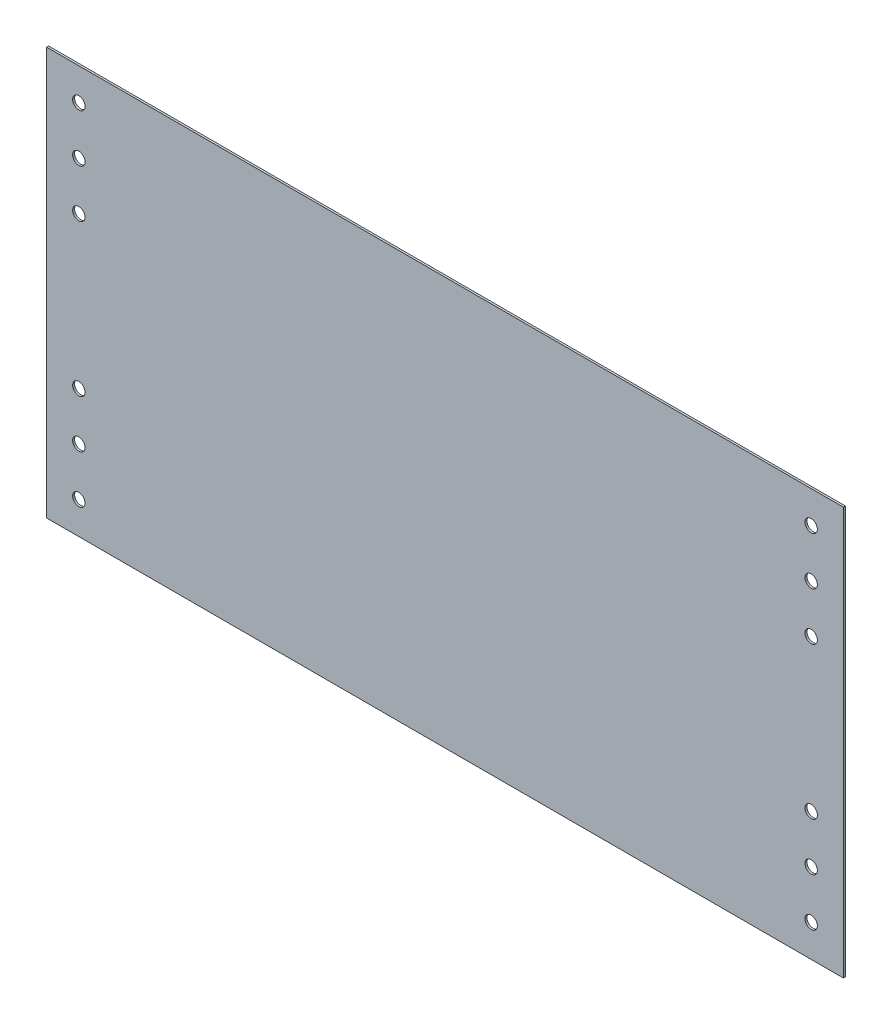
SolidWorks part; units mm, degrees
ref_plane "Front Plane" through (0, 0, 0) normal (0, 0, 1) x (1, 0, 0)
ref_plane "Top Plane" through (0, 0, 0) normal (0, 1, 0) x (1, 0, 0)
ref_plane "Right Plane" through (0, 0, 0) normal (1, 0, 0) x (0, 0, -1)
sketch "Sketch1" plane through (0, 0, 0) normal (0, 0, 1) x (1, 0, 0)
  line L0 (-289.1991, 355.7444) -> (289.1991, 355.7444) construction
  point P0 (0, 152.4)
  point P3 (0, 355.7444)
  line B0 (-597.6938, 152.4) -> (597.6938, 152.4)
  arc B1 (-289.1991, 117.3914) -> (-289.1991, 126.9164) centre (-289.1991, 122.1539) ccw
  arc B2 (-289.1991, 79.492) -> (-289.1991, 89.017) centre (-289.1991, 84.2545) ccw
  arc B3 (-289.1991, 41.5925) -> (-289.1991, 51.1175) centre (-289.1991, 46.355) ccw
  arc B4 (-289.1991, 389.0819) -> (-289.1991, 398.6069) centre (-289.1991, 393.8444) ccw
  arc B5 (-289.1991, 351.1825) -> (-289.1991, 360.7075) centre (-289.1991, 355.945) ccw
  arc B6 (-289.1991, 313.283) -> (-289.1991, 322.808) centre (-289.1991, 318.0455) ccw
  arc B7 (289.1991, 398.6069) -> (289.1991, 389.0819) centre (289.1991, 393.8444) ccw
  arc B8 (289.1991, 360.7075) -> (289.1991, 351.1825) centre (289.1991, 355.945) ccw
  arc B9 (289.1991, 322.808) -> (289.1991, 313.283) centre (289.1991, 318.0455) ccw
  arc B10 (289.1991, 126.9164) -> (289.1991, 117.3914) centre (289.1991, 122.1539) ccw
  arc B11 (289.1991, 89.017) -> (289.1991, 79.492) centre (289.1991, 84.2545) ccw
  arc B12 (289.1991, 51.1175) -> (289.1991, 41.5925) centre (289.1991, 46.355) ccw
  dimension "D1" = 152.4
  dimension "D2" = 38.1
sketch_block_instance "Block1-1"
sketch_block "Block1"
sketch "Holes to lineup" plane through (0, 0, 0) normal (0, 0, 1) x (1, 0, 0)
  line L0 (-289.1991, 241.8455) -> (289.1991, 241.8455)
  point P2 (0, 241.8455)
  arc B0 (-289.1991, 312.8819) -> (-289.1991, 322.4069) centre (-289.1991, 317.6444) ccw
  arc B1 (-289.1991, 274.9825) -> (-289.1991, 284.5075) centre (-289.1991, 279.745) ccw
  arc B2 (-289.1991, 237.083) -> (-289.1991, 246.608) centre (-289.1991, 241.8455) ccw
  arc B3 (289.1991, 322.4069) -> (289.1991, 312.8819) centre (289.1991, 317.6444) ccw
  arc B4 (289.1991, 284.5075) -> (289.1991, 274.9825) centre (289.1991, 279.745) ccw
  arc B5 (289.1991, 246.608) -> (289.1991, 237.083) centre (289.1991, 241.8455) ccw
  dimension "D1" = 76.2
sketch_block_instance "Block2-2"
sketch_block "Block2"
sketch "Sketch2" plane through (0, 0, 0) normal (0, 0, 1) x (1, 0, 0)
  line L1 (-314.5991, 343.0444) -> (314.5991, 343.0444)
  line L2 (-314.5991, 343.0444) -> (-314.5991, 20.955)
  line L3 (-314.5991, 20.955) -> (314.5991, 20.955)
  line L4 (314.5991, 343.0444) -> (314.5991, 20.955)
  dimension "D1" = 25.4
  dimension "D2" = 25.4
  dimension "D3" = 25.4
  dimension "D4" = 25.4
extrude "Boss-Extrude1" add sketch "Sketch2" along normal blind 1.5875
sketch "Sketch3" plane through (0, 0, 0) normal (0, 0, 1) x (1, 0, 0)
  circle A0 centre (-289.1991, 317.6444) radius 4.9022
  circle A1 centre (-289.1991, 279.745) radius 4.9022
  circle A2 centre (-289.1991, 241.8455) radius 4.9022
  circle A3 centre (289.1991, 317.6444) radius 4.9022
  circle A4 centre (289.1991, 279.745) radius 4.9022
  circle A5 centre (289.1991, 241.8455) radius 4.9022
  circle A6 centre (-289.1991, 122.1539) radius 4.9022
  circle A7 centre (-289.1991, 84.2545) radius 4.9022
  circle A8 centre (-289.1991, 46.355) radius 4.9022
  circle A9 centre (289.1991, 122.1539) radius 4.9022
  circle A10 centre (289.1991, 84.2545) radius 4.9022
  circle A11 centre (289.1991, 46.355) radius 4.9022
  arc A18 (289.1991, 126.9164) -> (289.1991, 117.3914) centre (289.1991, 122.1539) ccw construction
  arc A19 (289.1991, 89.017) -> (289.1991, 79.492) centre (289.1991, 84.2545) ccw construction
  arc A20 (289.1991, 51.1175) -> (289.1991, 41.5925) centre (289.1991, 46.355) ccw construction
  arc A21 (-289.1991, 117.3914) -> (-289.1991, 126.9164) centre (-289.1991, 122.1539) ccw construction
  arc A22 (-289.1991, 79.492) -> (-289.1991, 89.017) centre (-289.1991, 84.2545) ccw construction
  arc A23 (-289.1991, 41.5925) -> (-289.1991, 51.1175) centre (-289.1991, 46.355) ccw construction
  arc A24 (-289.1991, 237.083) -> (-289.1991, 246.608) centre (-289.1991, 241.8455) ccw construction
  arc A25 (-289.1991, 274.9825) -> (-289.1991, 284.5075) centre (-289.1991, 279.745) ccw construction
  arc A26 (-289.1991, 312.8819) -> (-289.1991, 322.4069) centre (-289.1991, 317.6444) ccw construction
  arc A27 (289.1991, 322.4069) -> (289.1991, 312.8819) centre (289.1991, 317.6444) ccw construction
  arc A28 (289.1991, 284.5075) -> (289.1991, 274.9825) centre (289.1991, 279.745) ccw construction
  arc A29 (289.1991, 246.608) -> (289.1991, 237.083) centre (289.1991, 241.8455) ccw construction
  dimension "D1" = 9.8044
  dimension "D2" = 9.8044
  dimension "D3" = 9.8044
  dimension "D4" = 9.8044
  dimension "D5" = 9.8044
  dimension "D6" = 9.8044
  dimension "D7" = 9.8044
  dimension "D8" = 9.8044
  dimension "D9" = 9.8044
  dimension "D10" = 9.8044
  dimension "D11" = 9.8044
  dimension "D12" = 9.8044
extrude "Cut-Extrude1" cut sketch "Sketch3" along normal through all
